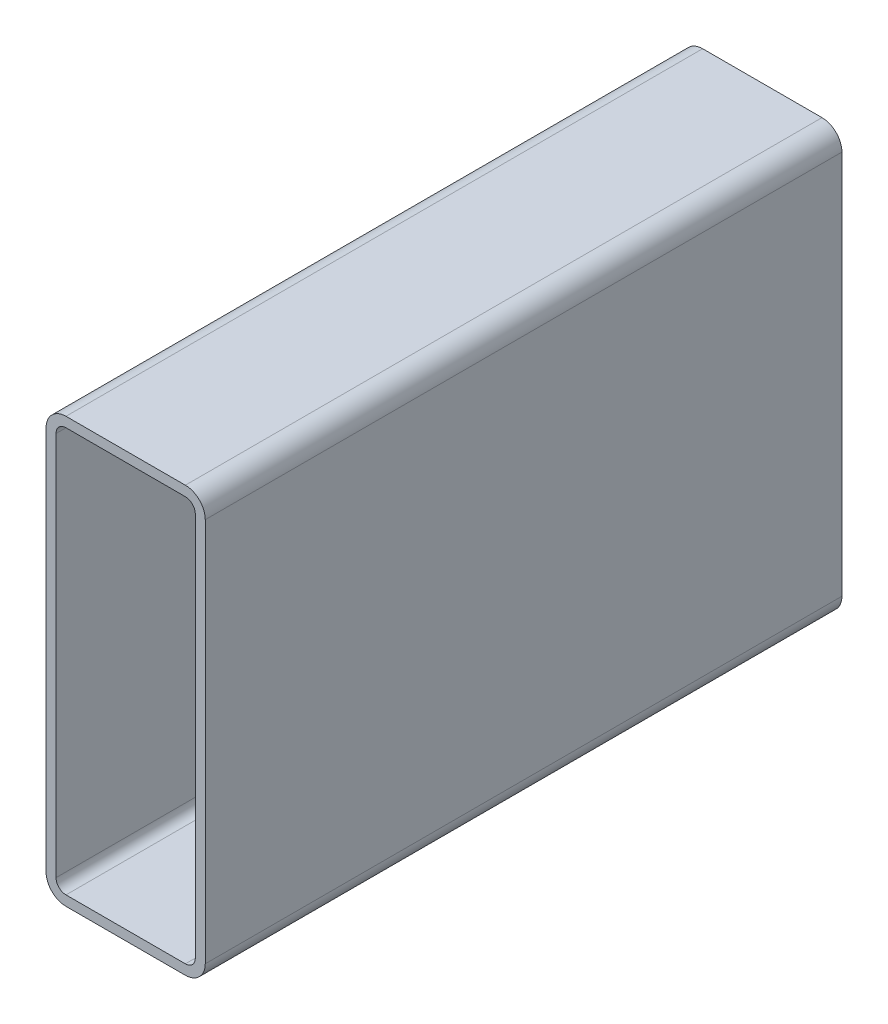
SolidWorks part; units mm, degrees
ref_plane "Front Plane" through (0, 0, 0) normal (0, 0, 1) x (1, 0, 0)
ref_plane "Top Plane" through (0, 0, 0) normal (0, 1, 0) x (1, 0, 0)
ref_plane "Right Plane" through (0, 0, 0) normal (1, 0, 0) x (0, 0, -1)
sketch "Sketch1" plane through (0, 0, 0) normal (0, 0, 1) x (1, 0, 0)
sketch_block_instance "HSS8x3x0.1875-1"
sketch_block "HSS8x3x0.1875"
extrude "Boss-Extrude1" add sketch "Sketch1" along normal blind 304.8
